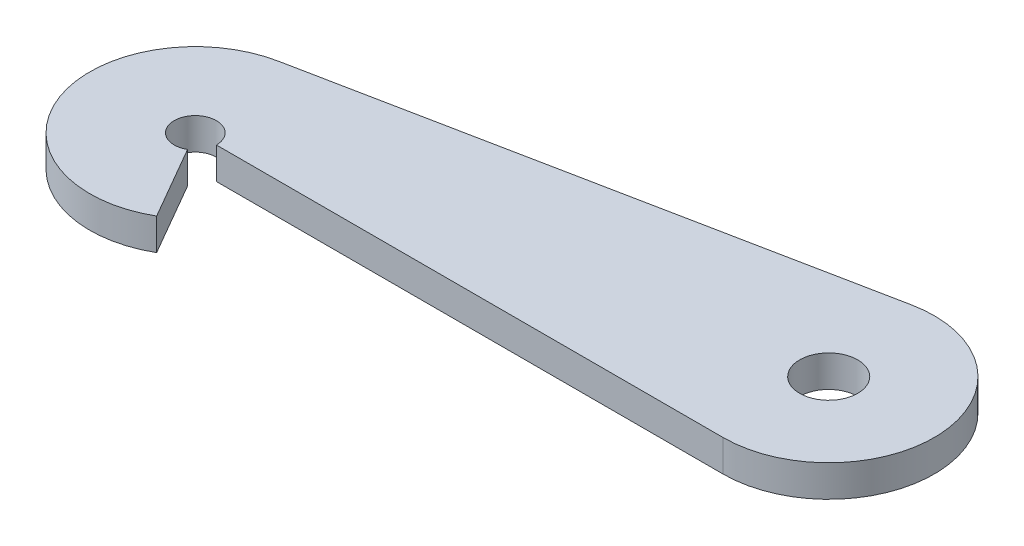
SolidWorks part; units mm, degrees
ref_plane "Front Plane" through (0, 0, 0) normal (0, 0, 1) x (1, 0, 0)
ref_plane "Top Plane" through (0, 0, 0) normal (0, 1, 0) x (1, 0, 0)
ref_plane "Right Plane" through (0, 0, 0) normal (1, 0, 0) x (0, 0, -1)
sketch "Sketch1" plane through (0, 0, 0) normal (0, 1, 0) x (1, 0, 0)
  line L0 (0, 10) -> (50, 10) construction
  line L1 (48.0388, 19.8058) -> (-1.9612, 9.8058)
  line L2 (50, 0) -> (2, 0)
  line L3 (1, -1.7321) -> (5, -8.6603)
  line L4 (1, -1.7321) -> (0, 0) construction
  arc A0 (2, 0) -> (1, -1.7321) centre (0, 0) ccw
  arc A1 (-1.9612, 9.8058) -> (5, -8.6603) centre (0, 0) ccw
  circle A2 centre (50, 10) radius 2.75
  arc A3 (50, 0) -> (48.0388, 19.8058) centre (50, 10) ccw
  dimension "D2" = 10
  dimension "D3" = 10
  dimension "D4" = 5.5
  dimension "D5" = 50
  dimension "D6" = 2
  dimension "D1" = 60
extrude "Extrude1" add sketch "Sketch1" along normal blind 3
